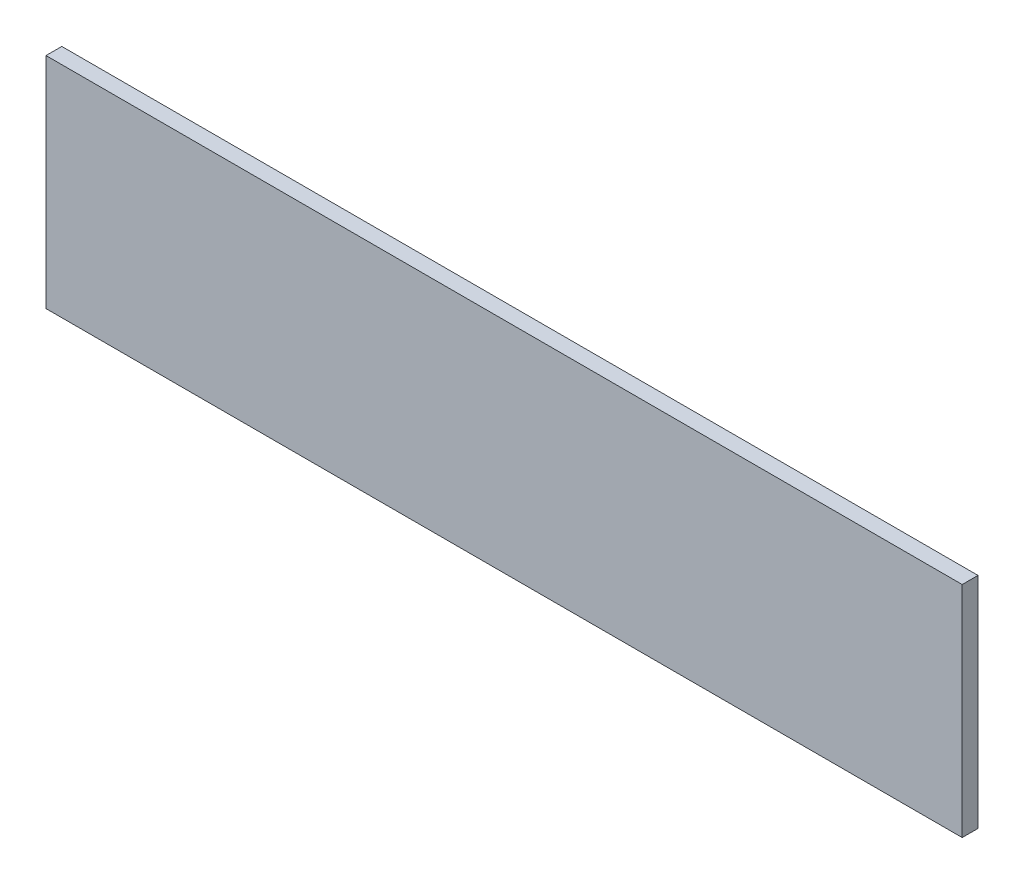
SolidWorks part; units mm, degrees
ref_plane "Plan de face" through (0, 0, 0) normal (0, 0, 1) x (1, 0, 0)
ref_plane "Plan de dessus" through (0, 0, 0) normal (0, 1, 0) x (1, 0, 0)
ref_plane "Plan de droite" through (0, 0, 0) normal (1, 0, 0) x (0, 0, -1)
sketch "Esquisse1" plane through (0, 0, 0) normal (0, 0, 1) x (1, 0, 0)
  line L21 (-72.5437, -117.0346) -> (507.4563, -117.0346)
  line L23 (507.4563, 21.7054) -> (-72.5437, 21.7054)
  line L24 (-72.5437, 21.7054) -> (-72.5437, -117.0346)
  line L25 (507.4563, 21.7054) -> (507.4563, -117.0346)
  dimension "D1" = 580
  dimension "D3" = 580
  dimension "D4" = 138.74
extrude "Boss.-Extru.1" add sketch "Esquisse1" along normal blind 10
sketch "Esquisse2" plane through (0, 0, 10) normal (0, 0, 1) x (1, 0, 0)
  line L0 (-82.5437, 11.7054) -> (-82.5437, -107.0346) construction
  text T0 "Cohabit  " font "Century Gothic" height 50
  dimension "D3" = 162.5
